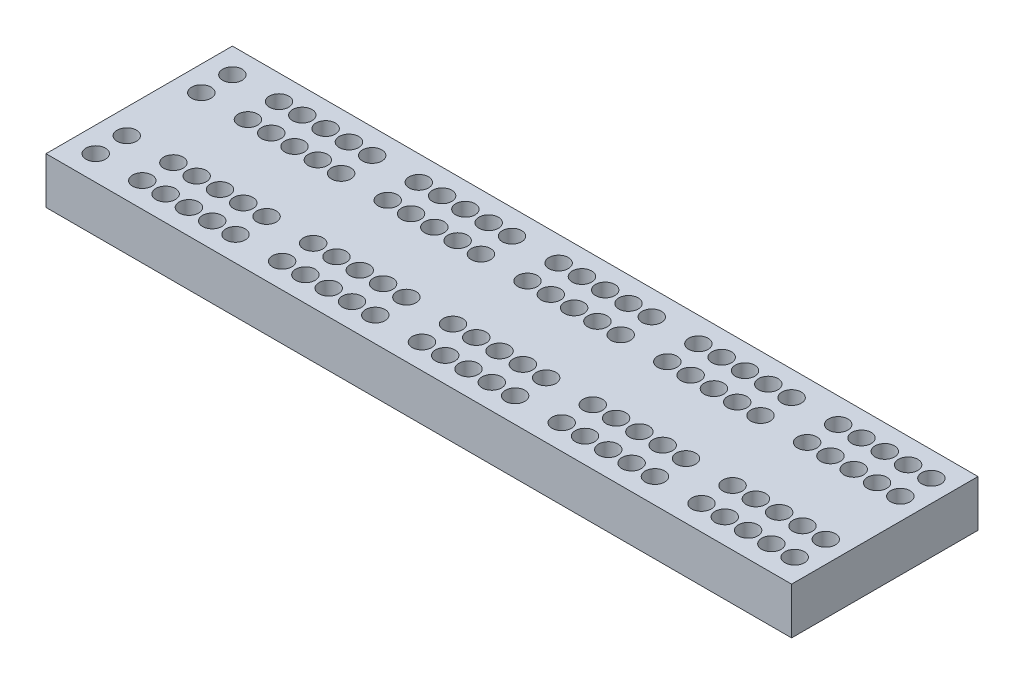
SolidWorks part; units mm, degrees
ref_plane "Front Plane" through (0, 0, 0) normal (0, 0, 1) x (1, 0, 0)
ref_plane "Top Plane" through (0, 0, 0) normal (0, 1, 0) x (1, 0, 0)
ref_plane "Right Plane" through (0, 0, 0) normal (1, 0, 0) x (0, 0, -1)
sketch "Sketch1" plane through (0, 0, 0) normal (0, 0, 1) x (1, 0, 0)
  line L1 (0, 0) -> (304.8, 0)
  line L2 (0, 0) -> (0, 19.05)
  line L3 (0, 19.05) -> (304.8, 19.05)
  line L4 (304.8, 0) -> (304.8, 19.05)
  dimension "D1" = 304.8
  dimension "D2" = 19.05
extrude "Extrude1" add sketch "Sketch1" along normal mid plane 76.2
hole_wizard "5/16 (0.3125) Diameter Hole1" positions "Sketch3" profile "Sketch2" hole size "5/16" standard "Ansi Inch"
sketch "Sketch3" plane through (0, 19.05, 0) normal (0, 1, 0) x (-1, 0, 0)
  line L0 (0, 38.1) -> (0, -38.1) construction
  line L1 (-304.8, -38.1) -> (0, -38.1) construction
  point P0 (-10.16, -27.94)
  dimension "D1" = 10.16
  dimension "D2" = 10.16
sketch "Sketch2" plane through (10.16, 19.05, -27.94) normal (1, 0, 0) x (0, 0, 1)
  line L0 (0, 0) -> (0, 15.0847)
  line L1 (0, 15.0847) -> (3.9687, 12.7)
  line L2 (3.9687, 12.7) -> (3.9687, 0)
  line L5 (3.9687, 0) -> (0, 0)
  line L10 (0, 15.0847) -> (-3.9688, 12.7) construction
  line L11 (0, -6.35) -> (0, 107.95) construction
  dimension "Hole Dia." = 7.9375
  dimension "Hole Depth" = 12.7
  dimension "Drill Angle" = 118
pattern_linear "LPattern1" count 31 spacing 9.525 along (1, 0, 0) count 2 spacing 12.7 along (0, 0, 1) of "5/16 (0.3125) Diameter Hole1"
mirror "Mirror1" about plane through (0, 0, 0) normal (0, 0, 1) of "LPattern1", "5/16 (0.3125) Diameter Hole1"
